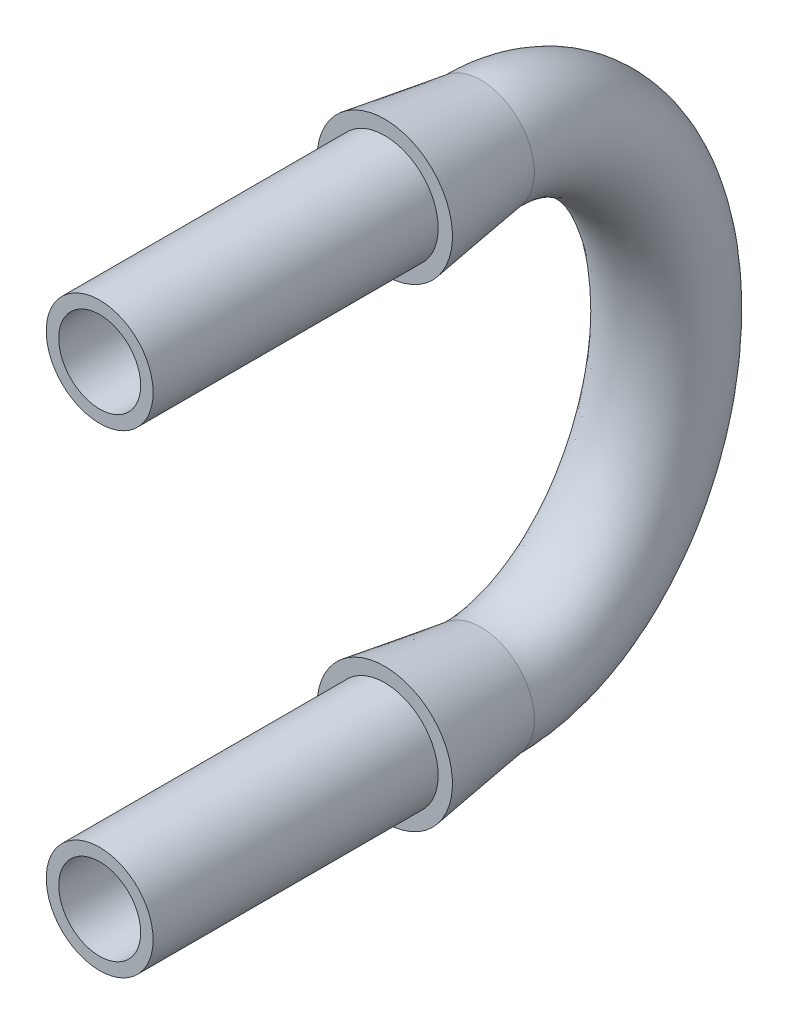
SolidWorks part; units mm, degrees
ref_plane "Front Plane" through (0, 0, 0) normal (0, 0, 1) x (1, 0, 0)
ref_plane "Top Plane" through (0, 0, 0) normal (0, 1, 0) x (1, 0, 0)
ref_plane "Right Plane" through (0, 0, 0) normal (1, 0, 0) x (0, 0, -1)
sketch "Sketch1" plane through (0, 0, 0) normal (0, 0, 1) x (1, 0, 0)
  circle A0 centre (0, 0) radius 5.75
  circle A1 centre (0, 0) radius 7.5
  dimension "D1" = 11.5
  dimension "D2" = 15
extrude "Boss-Extrude3" add sketch "Sketch1" against normal blind 43.5
sketch "Sketch4" plane through (0, 0, 0) normal (1, 0, 0) x (0, 0, -1)
  line L0 (43.5, 7.5) -> (30, 7.5)
  line L1 (43.5, 7.5) -> (0, 7.5) construction
  line L2 (30, 7.5) -> (30, 9.5)
  line L3 (30, 9.5) -> (43.5, 7.5)
  line L4 (43.5, 0) -> (35.8898, 0)
  line L5 (43.5, -7.5) -> (43.5, 7.5) construction
  dimension "D1" = 13.5
  dimension "D2" = 2
revolve "Revolve1" add sketch "Sketch4" angle 360 about L4
sketch3d "3DSketch1"
  line L2 (0, 33.25, -43.5) -> (0, 33.25, -23.0374)
  line L3 (0, 33.25, -23.0374) -> (21.4772, 33.25, -23.0374)
ref_plane "Plane1" through (0, 33.25, 0) normal (0, -1, 0) x (-1, 0, 0)
sketch "Sketch7" plane through (0, 0, -43.5) normal (0, 0, -1) x (-1, 0, 0)
  circle A0 centre (0, 0) radius 5.75
  circle A1 centre (0, 0) radius 7.5
  circle A2 centre (0, 0) radius 7.5
  dimension "D1" = 0
sketch "Sketch8" plane through (0, 0, 0) normal (1, 0, 0) x (0, 0, -1)
  line L4 (43.5, -7.5) -> (43.5, 7.5) construction
  ellipse E0 centre (43.5, 33.25) end of major axis (43.5, 0) minor radius 26 (43.5, 0) -> (43.5, 66.5) ccw
mirror "Mirror5" about plane through (0, 33.25, 0) normal (0, -1, 0)
sweep "Sweep13" add profiles "Sketch7" path "Sketch8"
sketch "Sketch10" plane through (0, 0, 0) normal (0, 0, 1) x (1, 0, 0)
  circle A0 centre (0, 0) radius 5.75
  circle A1 centre (0, 0) radius 7.5
  circle A2 centre (0, 0) radius 7.5
  circle A3 centre (0, 66.5) radius 5.75
  circle A4 centre (0, 66.5) radius 7.5
  dimension "D1" = 0
extrude "Boss-Extrude4" add sketch "Sketch10" along normal blind 10
